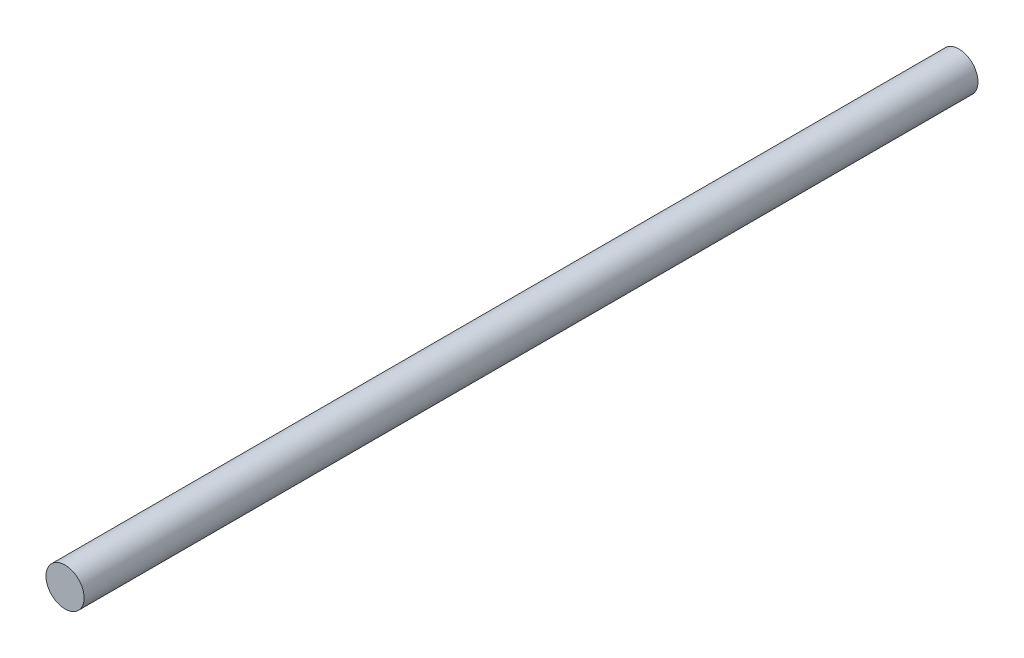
SolidWorks part; units mm, degrees
ref_plane "Спереди" through (0, 0, 0) normal (0, 0, 1) x (1, 0, 0)
ref_plane "Сверху" through (0, 0, 0) normal (0, 1, 0) x (1, 0, 0)
ref_plane "Справа" through (0, 0, 0) normal (1, 0, 0) x (0, 0, -1)
other "Configuration Table"
sketch "Эскиз1" plane through (0, 0, 0) normal (0, 0, 1) x (1, 0, 0)
  circle A0 centre (0, 0) radius 1.6
  dimension "D1" = 3.2
extrude "Бобышка-Вытянуть1" add sketch "Эскиз1" along normal blind 75
sketch3d "Трехмерный эскиз1"
  line L0 (0, 0, 75) -> (0, 0, 0) construction
  line L1 (0, 0, 75) -> (0, 0, 0) construction
